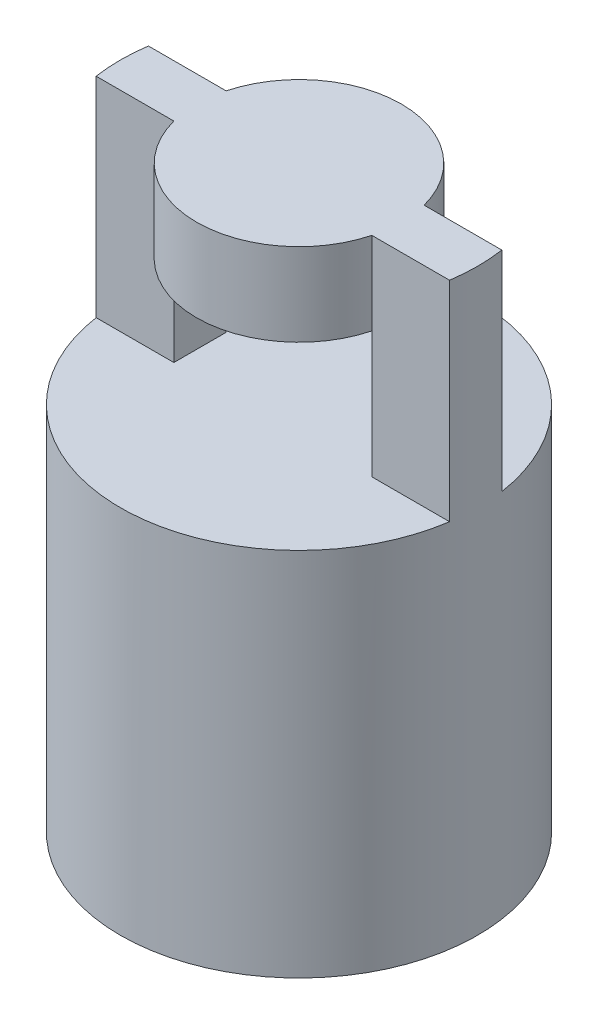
SolidWorks part; units mm, degrees
ref_plane "Plan de face" through (0, 0, 0) normal (0, 0, 1) x (1, 0, 0)
ref_plane "Plan de dessus" through (0, 0, 0) normal (0, 1, 0) x (1, 0, 0)
ref_plane "Plan de droite" through (0, 0, 0) normal (1, 0, 0) x (0, 0, -1)
sketch "Esquisse1" plane through (0, 0, 0) normal (0, 1, 0) x (1, 0, 0)
  circle A0 centre (0, 0) radius 4.1
extrude "Boss.-Extru.1" add sketch "Esquisse1" along normal blind 13.3
sketch "Esquisse2" plane through (0, 13.3, 0) normal (0, 1, 0) x (1, 0, 0)
  line L0 (4.4545, 0) -> (-6.5048, 0) construction
  line L1 (-6.5048, 0.6) -> (4.4545, 0.6) construction
  line L2 (-4.0559, 0.6) -> (-2.2721, 0.6)
  line L3 (2.2721, 0.6) -> (4.0559, 0.6)
  line L4 (2.2721, -0.6) -> (4.0559, -0.6)
  line L5 (-4.0559, -0.6) -> (-2.2721, -0.6)
  arc A0 (2.2721, 0.6) -> (-2.2721, 0.6) centre (0, 0) ccw
  arc A1 (4.0559, 0.6) -> (-4.0559, 0.6) centre (0, 0) ccw
  arc A2 (2.2721, -0.6) -> (-2.2721, -0.6) centre (0, 0) cw
  arc A3 (4.0559, -0.6) -> (-4.0559, -0.6) centre (0, 0) cw
  dimension "D1" = 0.6
extrude "Enlèv. mat.-Extru.1" cut sketch "Esquisse2" against normal blind 4.8
sketch "Esquisse3" plane through (0, 0, 0) normal (0, 0, 1) x (1, 0, 0)
  line L0 (0, 13.6742) -> (0, 5.8368) construction
  line L1 (-5.0449, 13.3) -> (4.3448, 13.3) construction
  line L2 (-5.0449, 11.4) -> (4.3448, 11.4) construction
  line L3 (-2.2721, 13.6742) -> (-2.2721, 7.5717) construction
  line L4 (2.2721, 13.6742) -> (2.2721, 7.5717) construction
  line L5 (-5.0449, 8.5) -> (4.3448, 8.5) construction
  line L7 (-2.2721, 11.4) -> (2.2721, 11.4)
  line L8 (-2.2721, 11.4) -> (-2.2721, 8.5)
  line L9 (-2.2721, 8.5) -> (2.2721, 8.5)
  line L10 (2.2721, 11.4) -> (2.2721, 8.5)
  dimension "D1" = 1.9
extrude "Enlèv. mat.-Extru.2" cut sketch "Esquisse3" against normal mid plane 10
sketch "Esquisse4" plane through (0, 0, 0) normal (0, -1, 0) x (1, 0, 0)
  circle A0 centre (0, 0) radius 1.5
extrude "Enlèv. mat.-Extru.3" cut sketch "Esquisse4" against normal blind 8
